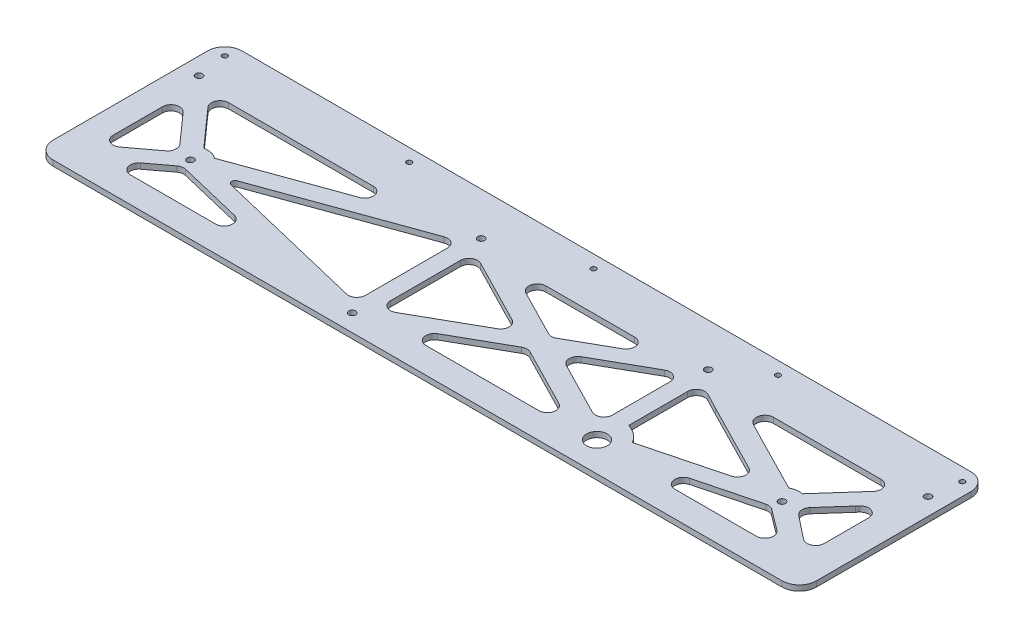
SolidWorks part; units mm, degrees
ref_plane "Front" through (0, 0, 0) normal (0, 0, 1) x (1, 0, 0)
ref_plane "Top" through (0, 0, 0) normal (0, 1, 0) x (1, 0, 0)
ref_plane "Right" through (0, 0, 0) normal (1, 0, 0) x (0, 0, -1)
sketch "Sketch1" plane through (0, 0, 0) normal (0, 1, 0) x (1, 0, 0)
  line L0 (-26.7996, 0) -> (-26.7996, 40)
  line L1 (-26.7996, 0) -> (417.7004, 0)
  line L2 (-26.7996, 0) -> (-26.7996, 110)
  line L3 (-26.7996, 110) -> (417.7004, 110)
  line L4 (417.7004, 0) -> (417.7004, 110)
  line L5 (-26.7996, 40) -> (23.2004, 40)
  line L6 (417.7004, 0) -> (417.7004, 40)
  line L7 (417.7004, 40) -> (367.7004, 40)
  line L8 (23.2004, 40) -> (103.2004, 40)
  line L9 (367.7004, 40) -> (191.7004, 40)
  line L10 (-26.7996, 110) -> (-26.7996, 85)
  line L11 (-26.7996, 85) -> (417.7004, 85)
  line L12 (-26.7996, 85) -> (-16.7996, 85)
  line L13 (417.7004, 85) -> (407.7004, 85)
  line L14 (103.2004, 40) -> (191.7004, 40)
  line L15 (147.4504, 40) -> (147.4504, 85)
  line L16 (279.7004, 40) -> (279.7004, 85)
  line L17 (147.4504, 40) -> (147.4504, 10)
  line L18 (-26.7996, 110) -> (-26.7996, 102.5)
  line L19 (-26.7996, 102.5) -> (417.7004, 102.5)
  line L20 (-26.7996, 102.5) -> (-19.2996, 102.5)
  line L21 (417.7004, 102.5) -> (410.2004, 102.5)
  line L22 (195.4504, 102.5) -> (410.2004, 102.5)
  line L23 (-19.2996, 102.5) -> (195.4504, 102.5)
  line L24 (417.7004, 0) -> (417.7004, 17.2282)
  line L25 (417.7004, 17.2282) -> (282.7004, 17.2282)
  circle A10 centre (367.7004, 40) radius 2
  circle A11 centre (23.2004, 40) radius 2
  circle A25 centre (-16.7996, 85) radius 2
  circle A26 centre (407.7004, 85) radius 2
  circle A27 centre (147.4504, 85) radius 2
  circle A28 centre (279.7004, 85) radius 2
  circle A29 centre (147.4504, 10) radius 2
  circle A30 centre (195.4504, 102.5) radius 1.5
  circle A31 centre (-19.2996, 102.5) radius 1.5
  circle A32 centre (410.2004, 102.5) radius 1.5
  circle A33 centre (302.8254, 102.5) radius 1.5
  circle A34 centre (88.0754, 102.5) radius 1.5
  circle A35 centre (282.7004, 17.2282) radius 6
  dimension "D3" = 40
  dimension "D7" = 80
  dimension "D8" = 176
  dimension "D9" = 25
  dimension "D11" = 10
  dimension "D12" = 30
  dimension "D13" = 7.5
  dimension "D14" = 7.5
  dimension "D16" = 17.2282
  dimension "D1" = 110
  dimension "D2" = 444.5
  dimension "D4" = 50
  dimension "D5" = 40
  dimension "D6" = 50
  dimension "D10" = 10
  dimension "D15" = 7.5
  dimension "D17" = 135
extrude "Boss-Extrude1" add sketch "Sketch1" along normal blind 3.175
fillet "Fillet1" radius 10 4 edges at (417.7004, 1.5875, -110) (417.7004, 1.5875, 0) (-26.7996, 1.5875, 0) (-26.7996, 1.5875, -110)
sketch "Sketch2" plane through (0, 3.175, 0) normal (0, 1, 0) x (1, 0, 0)
  line L0 (23.2004, 40) -> (16.1294, 32.9289)
  line L1 (147.4504, 47.5) -> (152.4504, 47.5)
  line L2 (391.4375, 59.1782) -> (378.9401, 45.1187)
  line L3 (383.9634, 65.8218) -> (369.7169, 49.7946)
  line L4 (9732.2026, 3263.3975) -> (9728.9552, 3272.8555)
  line L5 (147.4504, 47.5) -> (142.4504, 47.5)
  line L6 (322.4478, 33.4546) -> (294.4087, 26.1989)
  line L7 (152.4504, 47.5) -> (152.4504, 67.9441)
  line L8 (-16.7996, 0) -> (407.7004, 0) construction
  line L9 (147.4504, 10) -> (147.4504, 0)
  line L10 (152.4504, 47.5) -> (152.4504, 27.2341)
  line L11 (142.4504, 47.5) -> (142.4504, 70.4046)
  line L12 (142.4504, 47.5) -> (142.4504, 22.7018)
  line L13 (147.4504, 10) -> (147.4504, 85)
  line L14 (147.4504, 85) -> (279.7004, 85)
  line L15 (279.7004, 85) -> (279.7004, 17.2282)
  line L16 (251.0087, 15) -> (185.2783, 15)
  line L17 (147.4504, 85) -> (-16.7996, 85)
  line L18 (-16.7996, 85) -> (23.2004, 40)
  line L19 (279.7004, 85) -> (407.7004, 85)
  line L20 (65.3254, 85) -> (65.3254, 80)
  line L21 (65.3254, 80) -> (5.4689, 80)
  line L22 (65.3254, 80) -> (89.687, 80)
  line L23 (190.2472, 80) -> (241.8726, 80)
  line L24 (322.713, 80) -> (385.432, 80)
  line L25 (279.7004, 51.1141) -> (274.7004, 51.1141)
  line L26 (279.7004, 51.1141) -> (284.7004, 51.1141)
  line L27 (274.7004, 51.1141) -> (274.7004, 34.284)
  line L28 (274.7004, 67.7659) -> (274.7004, 51.1141)
  line L29 (284.7004, 68.0769) -> (284.7004, 51.1141)
  line L30 (86.4989, 29.8603) -> (47.5547, 39.2634)
  line L31 (86.4989, 29.8603) -> (136.2769, 17.8415)
  line L32 (3.2004, 62.5) -> (6.9375, 65.8218)
  line L33 (23.2004, 40) -> (147.4504, 10)
  line L34 (85.3254, 25) -> (86.4989, 29.8603)
  line L35 (284.7004, 51.1141) -> (284.7004, 33.7148)
  line L36 (279.7004, 17.2282) -> (367.7004, 40)
  line L37 (367.7004, 40) -> (407.7004, 85)
  line L38 (383.9634, 65.8218) -> (389.169, 71.6782)
  line L39 (383.9634, 65.8218) -> (387.7004, 62.5)
  line L40 (391.4375, 59.1782) -> (387.7004, 62.5)
  line L41 (391.4375, 59.1782) -> (392.3703, 60.2665)
  line L42 (322.4478, 33.4546) -> (323.7004, 28.6141)
  line L43 (324.953, 23.7735) -> (323.7004, 28.6141)
  line L44 (329.0765, 24.8406) -> (364.2961, 33.9544)
  line L45 (322.4478, 33.4546) -> (340.0585, 38.0118)
  line L46 (324.953, 23.7735) -> (296.9139, 16.5178)
  line L47 (3.2004, 62.5) -> (-0.5366, 59.1782)
  line L48 (-0.5366, 59.1782) -> (12.2431, 44.801)
  line L49 (-0.5366, 59.1782) -> (-3.0625, 62.0198)
  line L50 (6.9375, 65.8218) -> (21.1839, 49.7946)
  line L51 (6.9375, 65.8218) -> (1.7318, 71.6782)
  line L52 (85.3254, 25) -> (84.1182, 20)
  line L53 (84.1182, 20) -> (26.4566, 33.9223)
  line L54 (30.3293, 32.9872) -> (63.9883, 24.8603)
  line L55 (330.3291, 15) -> (377.7004, 15)
  line L56 (407.7004, 10) -> (402.7004, 10)
  line L57 (401.1667, 31.1503) -> (401.1667, 57.0127)
  line L58 (367.7004, 40) -> (407.7004, 10)
  line L59 (390.7004, 29) -> (384.7004, 21)
  line L60 (23.2004, 40) -> (147.4504, 85)
  line L61 (83.5146, 67.5) -> (87.1363, 57.5)
  line L62 (83.5146, 67.5) -> (29.3522, 47.8839)
  line L63 (83.5146, 67.5) -> (91.3614, 70.2887)
  line L64 (87.1363, 57.5) -> (135.7478, 75.1058)
  line L65 (87.1363, 57.5) -> (47.3431, 43.088)
  line L66 (279.7004, 85) -> (367.7004, 40)
  line L67 (326.2572, 67.5) -> (321.1436, 57.5)
  line L68 (301.2048, 67.696) -> (341.0824, 47.304)
  line L69 (326.2572, 67.5) -> (320.3935, 70.5706)
  line L70 (326.2572, 67.5) -> (362.8903, 48.7672)
  line L71 (147.4504, 85) -> (279.7004, 17.2282)
  line L72 (218.7979, 42.1248) -> (253.2889, 24.4498)
  line L73 (216.1377, 56.1141) -> (211.0132, 46.1141)
  line L74 (197.4862, 53.046) -> (159.7307, 72.3939)
  line L75 (215.0566, 56.6681) -> (187.9669, 70.5502)
  line L76 (236.3682, 45.7469) -> (267.4201, 29.8343)
  line L77 (147.4504, 10) -> (279.7004, 85)
  line L78 (211.1089, 51.8493) -> (216.0419, 43.1507)
  line L79 (219.799, 56.7661) -> (244.3347, 70.6483)
  line L80 (236.1863, 54.5484) -> (267.2382, 72.1176)
  line L81 (197.6682, 44.2445) -> (159.9126, 22.8824)
  line L82 (214.0554, 42.0268) -> (182.8161, 24.3517)
  line L83 (-16.7996, 85) -> (-16.7996, 15)
  line L84 (-11.7996, 10) -> (147.4504, 10)
  line L85 (147.4504, 10) -> (402.7004, 10)
  line L86 (407.7004, 85) -> (407.7004, 15)
  line L87 (-16.7996, 10) -> (-16.7996, 15)
  line L88 (-16.7996, 10) -> (-11.7996, 10)
  line L89 (13.2004, 15) -> (62.8148, 15)
  line L90 (-11.7996, 30) -> (-11.7996, 58.698)
  line L91 (390.7004, 29) -> (379.559, 37.8883)
  line L92 (388.7004, 18) -> (380.7004, 24)
  line L93 (380.7004, 24) -> (368.5487, 33.1138)
  line L94 (390.7004, 29) -> (393.1667, 27.1503)
  line L95 (23.2004, 40) -> (-16.7996, 10)
  line L96 (0.2004, 29) -> (6.2004, 21)
  line L97 (11.506, 37.4792) -> (-3.7996, 26)
  line L98 (10.2004, 24) -> (22.2831, 33.062)
  line L100 (6.2004, 21) -> (-8.4662, 10)
  line L101 (301.2048, 67.696) -> (292.0202, 72.5062)
  arc A0 (-3.0625, 62.0198) -> (-11.7996, 58.698) centre (-6.7996, 58.698) ccw
  arc A3 (219.799, 56.7661) -> (215.0566, 56.6681) centre (217.3369, 61.1179) cw
  arc A4 (241.8726, 80) -> (244.3347, 70.6483) centre (241.8726, 75) cw
  circle A5 centre (147.4504, 85) radius 10
  arc A7 (190.2472, 80) -> (187.9669, 70.5502) centre (190.2472, 75) ccw
  circle A8 centre (279.7004, 85) radius 10
  arc A10 (5.4689, 80) -> (1.7318, 71.6782) centre (5.4689, 75) ccw
  arc A11 (89.687, 80) -> (91.3614, 70.2887) centre (89.687, 75) cw
  arc A12 (135.7478, 75.1058) -> (142.4504, 70.4046) centre (137.4504, 70.4046) cw
  arc A13 (142.4504, 22.7018) -> (136.2769, 17.8415) centre (137.4504, 22.7018) cw
  arc A14 (47.5547, 39.2634) -> (47.3431, 43.088) centre (48.0241, 41.2075) cw
  arc A15 (159.9126, 22.8824) -> (152.4504, 27.2341) centre (157.4504, 27.2341) cw
  arc A16 (197.6682, 44.2445) -> (197.4862, 53.046) centre (195.206, 48.5962) ccw
  arc A17 (159.7307, 72.3939) -> (152.4504, 67.9441) centre (157.4504, 67.9441) ccw
  arc A18 (274.7004, 34.284) -> (267.4201, 29.8343) centre (269.7004, 34.284) cw
  circle A19 centre (147.4504, 10) radius 10
  circle A21 centre (23.2004, 40) radius 10
  circle A22 centre (9732.2026, 3263.3975) radius 10
  circle A24 centre (-16.7996, 85) radius 10
  circle A25 centre (407.7004, 85) radius 10
  circle A26 centre (279.7004, 17.2282) radius 17.2282
  circle A27 centre (367.7004, 40) radius 10
  arc A28 (236.1863, 54.5484) -> (236.3682, 45.7469) centre (238.6485, 50.1967) ccw
  arc A29 (274.7004, 67.7659) -> (267.2382, 72.1176) centre (269.7004, 67.7659) ccw
  arc A30 (341.0824, 47.304) -> (340.0585, 38.0118) centre (338.8059, 42.8523) cw
  arc A31 (322.713, 80) -> (320.3935, 70.5706) centre (322.713, 75) ccw
  arc A32 (292.0202, 72.5062) -> (284.7004, 68.0769) centre (289.7004, 68.0769) ccw
  arc A33 (385.432, 80) -> (389.169, 71.6782) centre (385.432, 75) cw
  arc A34 (379.559, 37.8883) -> (378.9401, 45.1187) centre (382.6772, 41.7969) cw
  arc A35 (401.1667, 57.0127) -> (392.3703, 60.2665) centre (396.1667, 57.0127) ccw
  arc A36 (401.1667, 31.1503) -> (393.1667, 27.1503) centre (396.1667, 31.1503) cw
  arc A37 (377.7004, 15) -> (380.7004, 24) centre (377.7004, 20) ccw
  arc A38 (218.7979, 42.1248) -> (214.0554, 42.0268) centre (216.5176, 37.675) ccw
  arc A39 (182.8161, 24.3517) -> (185.2783, 15) centre (185.2783, 20) ccw
  arc A40 (251.0087, 15) -> (253.2889, 24.4498) centre (251.0087, 20) ccw
  arc A41 (11.506, 37.4792) -> (12.2431, 44.801) centre (8.506, 41.4792) ccw
  arc A42 (-3.7996, 26) -> (-11.7996, 30) centre (-6.7996, 30) cw
  arc A43 (13.2004, 15) -> (10.2004, 24) centre (13.2004, 20) cw
  arc A44 (62.8148, 15) -> (63.9883, 24.8603) centre (62.8148, 20) ccw
  arc A45 (329.0765, 24.8406) -> (330.3291, 15) centre (330.3291, 20) ccw
  arc A46 (-11.7996, 10) -> (-16.7996, 15) centre (-11.7996, 15) cw
  arc A47 (402.7004, 10) -> (407.7004, 15) centre (402.7004, 15) ccw
  arc A48 (26.4566, 33.9223) -> (22.2831, 33.062) centre (25.2831, 29.062) ccw
  arc A49 (368.5487, 33.1138) -> (364.2961, 33.9544) centre (365.5487, 29.1138) ccw
  point P84 (213.5754, 13.6141)
  point P91 (85.3254, 62.5)
  point P98 (323.7004, 62.5)
  point P100 (321.1436, 57.5)
  point P106 (213.5754, 51.1141)
  point P109 (213.5754, 47.5)
  point P114 (211.0132, 46.1141)
  point P115 (213.5754, 47.5)
  point P128 (387.7004, 25)
  point P135 (3.2004, 25)
  point P136 (0.2004, 29)
  point P173 (384.7004, 21)
  dimension "D7" = 5
  dimension "D2" = 5
  dimension "D9" = 5
  dimension "D20" = 10
  dimension "D22" = 5
  dimension "D16" = 5
  dimension "D17" = 5
  dimension "D23" = 5
  dimension "D24" = 5
  dimension "D25" = 5
  dimension "D26" = 5
  dimension "D27" = 5
  dimension "D28" = 2
  dimension "D29" = 5
  dimension "D30" = 5
  dimension "D31" = 5
  dimension "D32" = 5
  dimension "D33" = 5
  dimension "D34" = 5
  dimension "D35" = 5
  dimension "D36" = 5
  dimension "D37" = 5
  dimension "D38" = 5
  dimension "D39" = 5
  dimension "D40" = 5
  dimension "D13" = 5
  dimension "D41" = 5
  dimension "D42" = 5
  dimension "D43" = 5
  dimension "D44" = 5
  dimension "D45" = 5
  dimension "D19" = 5
  dimension "D18" = 5
  dimension "D46" = 5
  dimension "D10" = 5
  dimension "D47" = 5
  dimension "D48" = 5
  dimension "D49" = 5
  dimension "D50" = 5
  dimension "D1" = 10
  dimension "D6" = 5
  dimension "D3" = 5
  dimension "D4" = 5
  dimension "D5" = 5
  dimension "D8" = 5
  dimension "D11" = 5
  dimension "D12" = 5
  dimension "D14" = 10
  dimension "D15" = 10
  dimension "D21" = 10
extrude "Cut-Extrude1" cut sketch "Sketch2" against normal blind 10 contours A21 L62 L63 A11 L22 L21 A10 L51 L50 | A42 L97 A41 A21 L48 L49 A0 L90 | L89 A44 L53 A21 L98 A43 | L53 A48 L98 A21 | A14 L30 L31 A13 L12 L11 A12 L64 L65 | L74 A17 L7 L10 A15 L81 A16 | L23 A7 L75 A3 L79 A4 | L16 A40 L72 A38 L82 A39 | L28 A29 L80 A28 L76 A18 A26 L27 | L101 A32 L29 L35 A26 L6 L45 A30 L68 | A18 A26 | A33 L24 A31 L69 L70 A27 L3 L38 | L44 A45 L55 A37 L93 A27 | A36 L57 A35 L41 L2 A34 L91 L94
equation "\"width\"=8.66025"
equation "\"supw\"=5"
